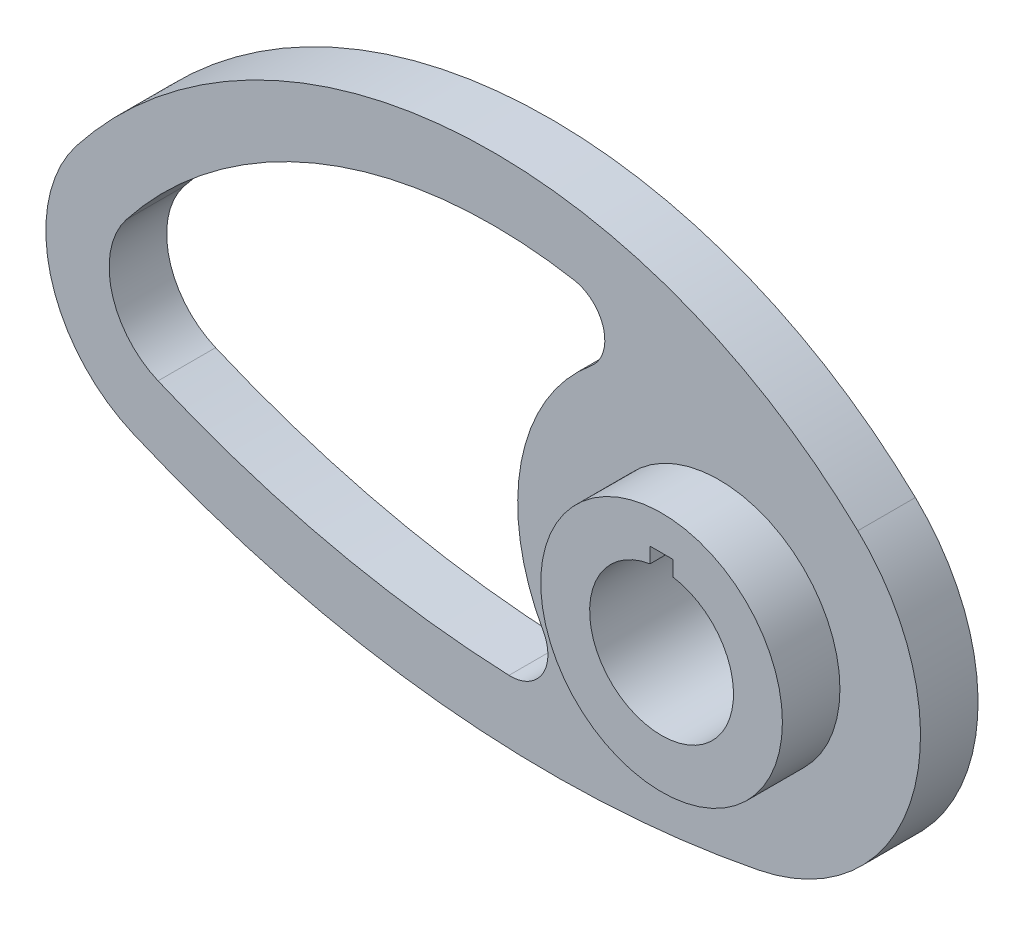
SolidWorks part; units mm, degrees
ref_plane "Front" through (0, 0, 0) normal (0, 0, 1) x (1, 0, 0)
ref_plane "Top" through (0, 0, 0) normal (0, 1, 0) x (1, 0, 0)
ref_plane "Right" through (0, 0, 0) normal (1, 0, 0) x (0, 0, -1)
sketch "Sketch1" plane through (0, 0, 0) normal (0, 0, 1) x (1, 0, 0)
  arc A0 (6.8022, -34.3326) -> (24.1076, 25.3737) centre (0, 0) ccw
  arc A1 (-111.6788, 15.419) -> (24.1076, 25.3737) centre (-39.2609, -41.3229) cw
  arc A2 (-111.6788, 15.419) -> (-101.82, -22.9906) centre (-92, 0) ccw
  arc A3 (-101.82, -22.9906) -> (6.8022, -34.3326) centre (-29.1522, 147.1399) ccw
  dimension "D1" = 35
  dimension "D2" = 92
  dimension "D3" = 25
  dimension "D4" = 185
  dimension "D5" = 92
extrude "Base-Extrude" add sketch "Sketch1" along normal mid plane 10
sketch "Sketch2" plane through (0, 0, 5) normal (0, 0, 1) x (1, 0, 0)
  arc A9 (-97.4992, -12.8747) -> (4.6643, -23.5424) centre (-29.1522, 147.1399) ccw
  arc A10 (-103.0201, 8.6346) -> (-97.4992, -12.8747) centre (-92, 0) ccw
  arc A11 (16.5309, 17.3991) -> (-103.0201, 8.6346) centre (-39.2609, -41.3229) ccw
  arc A12 (-97.4992, -12.8747) -> (-36.5219, -26.704) centre (-29.1522, 147.1399) ccw
  arc A13 (-103.0201, 8.6346) -> (-97.4992, -12.8747) centre (-92, 0) ccw
  arc A14 (-25.2361, 38.4537) -> (-103.0201, 8.6346) centre (-39.2609, -41.3229) ccw
  arc A15 (-22.2326, 27.0317) -> (-30.5694, -17.0444) centre (0, 0) ccw
  arc A16 (6.8022, -34.3326) -> (24.1076, 25.3737) centre (0, 0) ccw construction
  arc A17 (-25.2361, 38.4537) -> (-22.2326, 27.0317) centre (-26.3615, 32.0518) cw
  arc A18 (-36.5219, -26.704) -> (-30.5694, -17.0444) centre (-36.2466, -20.2098) ccw
  dimension "D2" = 6.5
  dimension "D1" = 11
extrude "Cut-Extrude1" cut sketch "Sketch2" against normal through all
sketch "Sketch3" plane through (0, 0, 5) normal (0, 0, 1) x (1, 0, 0)
  circle A0 centre (0, 0) radius 21
  dimension "D1" = 42
extrude "Boss-Extrude1" add sketch "Sketch3" along normal blind 10
sketch "Sketch4" plane through (0, 0, 15) normal (0, 0, 1) x (1, 0, 0)
  line L0 (0, 0) -> (0, -42.3208) construction
  line L2 (-2, 12.339) -> (-2, 15)
  line L3 (-2, 15) -> (2, 15)
  line L4 (2, 12.339) -> (2, 15)
  arc A0 (-2, 12.339) -> (2, 12.339) centre (0, 0) ccw
  dimension "D1" = 25
  dimension "D2" = 4
  dimension "D3" = 2.5
extrude "Cut-Extrude2" cut sketch "Sketch4" against normal through all
